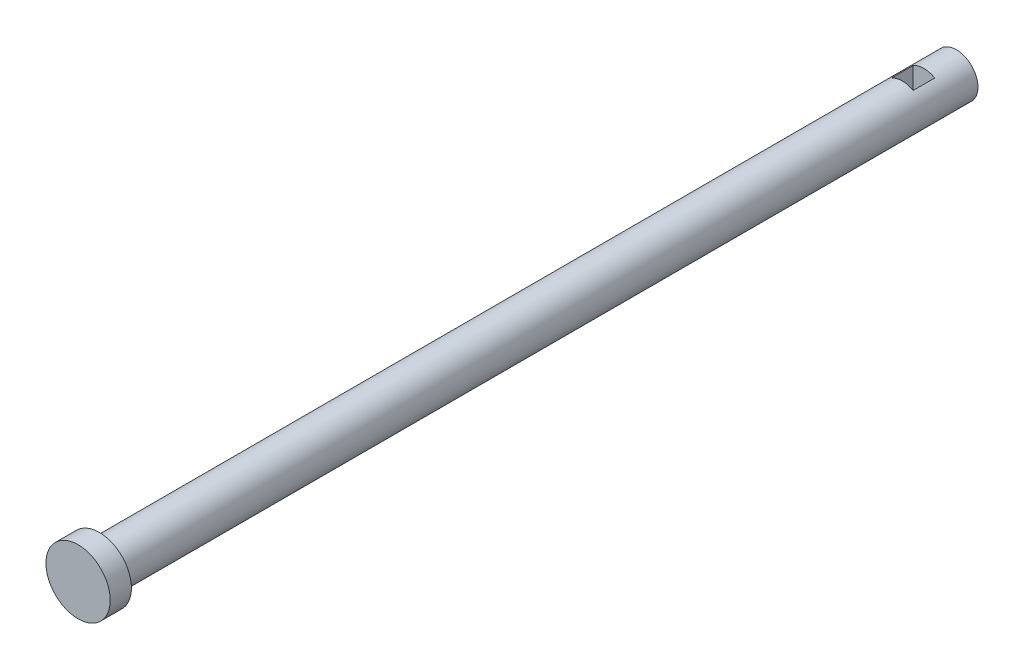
SolidWorks part; units mm, degrees
ref_plane "Alzado" through (0, 0, 0) normal (0, 0, 1) x (1, 0, 0)
ref_plane "Planta" through (0, 0, 0) normal (0, 1, 0) x (1, 0, 0)
ref_plane "Vista lateral" through (0, 0, 0) normal (1, 0, 0) x (0, 0, -1)
sketch "Croquis1" plane through (0, 0, 0) normal (0, 0, 1) x (1, 0, 0)
  circle A0 centre (0, 0) radius 10
  dimension "D1" = 20
extrude "Saliente-Extruir1" add sketch "Croquis1" along normal blind 395.8
sketch "Croquis2" plane through (0, 0, 395.8) normal (0, 0, 1) x (1, 0, 0)
  circle A0 centre (0, 0) radius 14.8408
extrude "Saliente-Extruir2" add sketch "Croquis2" along normal blind 9.8
sketch "Croquis3" plane through (0, 0, 0) normal (0, 1, 0) x (1, 0, 0)
  line L0 (0, 0) -> (0, -20) construction
  line L2 (-5, -25) -> (5, -25)
  line L3 (-5, -25) -> (-5, -15)
  line L4 (-5, -15) -> (5, -15)
  line L5 (5, -25) -> (5, -15)
  line L6 (-5, -25) -> (5, -15) construction
  line L7 (-5, -15) -> (5, -25) construction
  dimension "D1" = 20
  dimension "D2" = 10
  dimension "D3" = 10
extrude "Cortar-Extruir2" cut sketch "Croquis3" against normal through all and the other way through all
